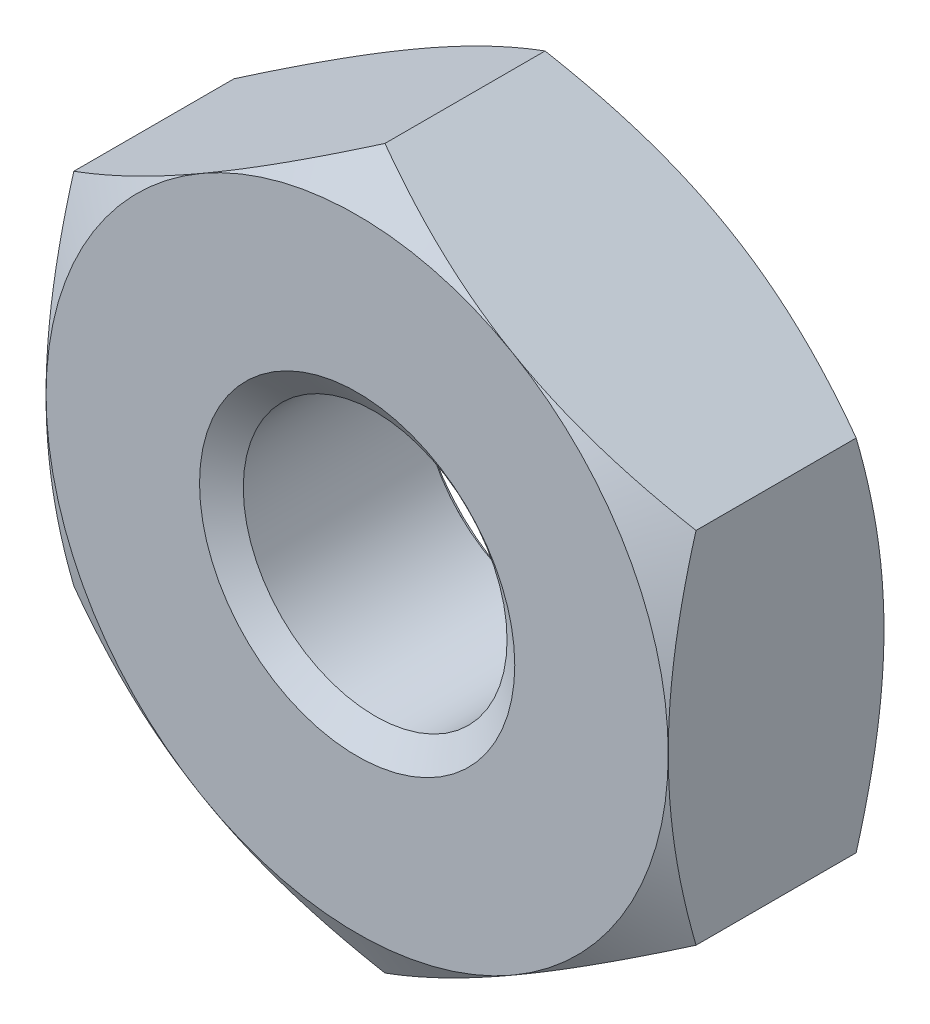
SolidWorks part; units mm, degrees
ref_plane "Plane1" through (0, 0, 0) normal (0, 0, 1) x (1, 0, 0)
ref_plane "Plane2" through (0, 0, 0) normal (0, 1, 0) x (1, 0, 0)
ref_plane "Plane3" through (0, 0, 0) normal (1, 0, 0) x (0, 0, -1)
revolve "EndChamfer" cut sketch "EndChamferSketch" angle 360 about L11
sketch "EndChamferSketch" plane through (0, 0, 0) normal (1, 0, 0) x (0, 0, -1)
  line L0 (3.2766, 2.413) -> (2.9734, 1.9799)
  line L1 (3.3274, 2.413) -> (3.2766, 2.413)
  line L2 (3.3274, 2.413) -> (3.3274, 1.9799)
  line L3 (3.3274, 1.9799) -> (2.9734, 1.9799)
  line L6 (-0.0508, 2.413) -> (0, 2.413)
  line L7 (0, 2.413) -> (0.3032, 1.9799)
  line L9 (0.3032, 1.9799) -> (-0.0508, 1.9799)
  line L10 (-0.0508, 1.9799) -> (-0.0508, 2.413)
  line L11 (25.0375, 0) -> (38.388, 0) construction
  dimension "D1" = 35
  dimension "D2" = 0.0508
  dimension "Offset1" = 3.3274
  dimension "ThreadMajor" = 2.413
  dimension "ChamferDepth" = 0.4331
  dimension "Offset2" = 3.3782
extrude "BaseNut" add sketch "BaseNutSke" against normal blind 3.302
sketch "BaseNutSke" plane through (0, 0, 0) normal (0, 0, 1) x (1, 0, 0)
  line L6 (4.7625, 2.7496) -> (4.7625, -2.7496)
  line L7 (-4.7625, 2.7496) -> (-4.7625, -2.7496)
  line L8 (4.7625, 2.7496) -> (0, 5.4993)
  line L9 (0, 5.4993) -> (-4.7625, 2.7496)
  line L10 (-4.7625, -2.7496) -> (0, -5.4993)
  line L11 (0, -5.4993) -> (4.7625, -2.7496)
  circle A0 centre (0, 0) radius 2.0193
  dimension "D4" = 4.7625
  dimension "Thread_min" = 4.0386
  dimension "D1" = 120
  dimension "D2" = 4.7625
  dimension "D3" = 4.7625
  dimension "Width_flats" = 9.525
sketch "Sketch4" plane through (0, 0, 0) normal (1, 0, 0) x (0, 0, -1)
  line L4 (0, 0) -> (34.925, 0) construction
  line L7 (0, 4.7625) -> (-12.7, 4.7625)
  line L8 (0, 2.7496) -> (0, 5.4993) construction
  line L9 (0.4254, 5.4993) -> (0.4254, 18.1993)
  line L10 (0.4254, 18.1993) -> (-12.7, 18.1993)
  line L11 (-12.7, 18.1993) -> (-12.7, 4.7625)
  line L12 (0, 4.7625) -> (0.4254, 5.4993)
  line L14 (0, 2.7496) -> (0, -2.7496) construction
  line L15 (3.302, 5.4993) -> (0, 5.4993) construction
  dimension "D1" = 4.7625
  dimension "D2" = 30
  dimension "D3" = 12.7
  dimension "D4" = 12.7
revolve "Single-Chamfer" [suppressed] cut sketch "Sketch4" angle 360 about L4
sketch "Sketch3" plane through (0, 0, 0) normal (1, 0, 0) x (0, 0, -1)
  line L0 (3.302, 4.7625) -> (2.8766, 5.4993)
  line L1 (2.8766, 5.4993) -> (2.8766, 18.1993)
  line L2 (2.8766, 18.1993) -> (16.002, 18.1993)
  line L3 (16.002, 18.1993) -> (16.002, 4.7625)
  line L4 (16.002, 4.7625) -> (3.302, 4.7625)
  line L5 (3.302, 2.7496) -> (3.302, 5.4993) construction
  line L6 (3.302, 5.4993) -> (0, 5.4993) construction
  line L7 (0, 0) -> (38.6776, 0) construction
  line L8 (3.302, 0) -> (0, 0) construction
  line L9 (1.651, 5.4993) -> (1.651, 44.222) construction
  line L10 (0.4254, 18.1993) -> (-12.7, 18.1993)
  line L11 (-12.7, 18.1993) -> (-12.7, 4.7625)
  line L12 (-12.7, 4.7625) -> (0, 4.7625)
  line L13 (0, 4.7625) -> (0.4254, 5.4993)
  line L14 (0.4254, 5.4993) -> (0.4254, 18.1993)
  line L16 (3.302, 5.4993) -> (0, 5.4993) construction
  dimension "D1" = 4.7625
  dimension "D2" = 30
  dimension "D3" = 12.7
  dimension "D4" = 12.7
revolve "Double-Chamfer" cut sketch "Sketch3" angle 360 about L7
sketch "ThdSchSke" plane through (0, 0, 0) normal (0, 1, 0) x (1, 0, 0)
  line L0 (-2.413, 0.0254) -> (-2.0193, 0.3011)
  line L1 (-2.0193, 0.3011) -> (-1.0096, 0.3011)
  line L2 (-1.0096, 0.3011) -> (-1.0096, -0.2503)
  line L3 (-1.0096, -0.2503) -> (-2.0193, -0.2503)
  line L4 (-2.0193, -0.2503) -> (-2.413, 0.0254)
  line L6 (0, 3.9624) -> (0, -2.9874) construction
  line L7 (-0.8255, 0.8179) -> (5.5245, 0.8179) construction
  dimension "D1" = 0.0254
  dimension "VeeAngle" = 70
  dimension "SideAngle" = 55
  dimension "OverCut" = 2.0193
  dimension "Advance" = 0.7925
  dimension "Thread_major" = 4.826
  dimension "Tap_drill" = 4.0386
revolve "ThreadSchematic" [suppressed] cut sketch "ThdSchSke" angle 360 about L6
pattern_linear "ThdSchPat" [suppressed]
equation "\"D2@BaseNutSke\" = \"Width_flats@BaseNutSke\" / 2"
equation "\"D3@BaseNutSke\" = \"Width_flats@BaseNutSke\" / 2"
equation "\"D1@Sketch3\" = \"Width_flats@BaseNutSke\" /2"
equation "\"D4@BaseNutSke\" = \"D3@BaseNutSke\""
equation "\"D1@Sketch4\" = \"Width_flats@BaseNutSke\" / 2"
equation "\"Thread_major@ThdSchSke\" = \"Thread_nominal@ThreadCosmetic\""
equation "\"Tap_drill@ThdSchSke\" = \"Thread_min@BaseNutSke\""
equation "\"Overcut@ThdSchSke\" = \"Tap_drill@ThdSchSke\" * 0.5"
equation "\"Num_threads@ThdSchPat\" = int(  ( \"Thickness@BaseNut\" - 0.002 ) / \"Advance@ThdSchSke\" + 0.999 )  + 1"
equation "\"Advance@ThdSchPat\" = ( \"Thickness@BaseNut\" - 0.002 ) /  (\"Num_threads@ThdSchPat\" - 1) 'relax it"
equation "' \"Num_threads@ThdSchPat\" = \"Num_threads@ThdSchPat\" - sgn( \"Num_threads@ThdSchPat\" - 1) '---chamfered tips only---"
equation "\"ThreadMajor@EndChamferSketch\" = \"Thread_nominal@ThreadCosmetic\" * 0.5"
equation "\"ChamferDepth@EndChamferSketch\" = (\"Thread_nominal@ThreadCosmetic\" - \"Thread_min@BaseNutSke\") * 0.55"
equation "\"Offset1@EndChamferSketch\" = \"Thickness@BaseNut\" + 0.001"
equation "\"Offset2@EndChamferSketch\" = \"Offset1@EndChamferSketch\" + 0.002"
